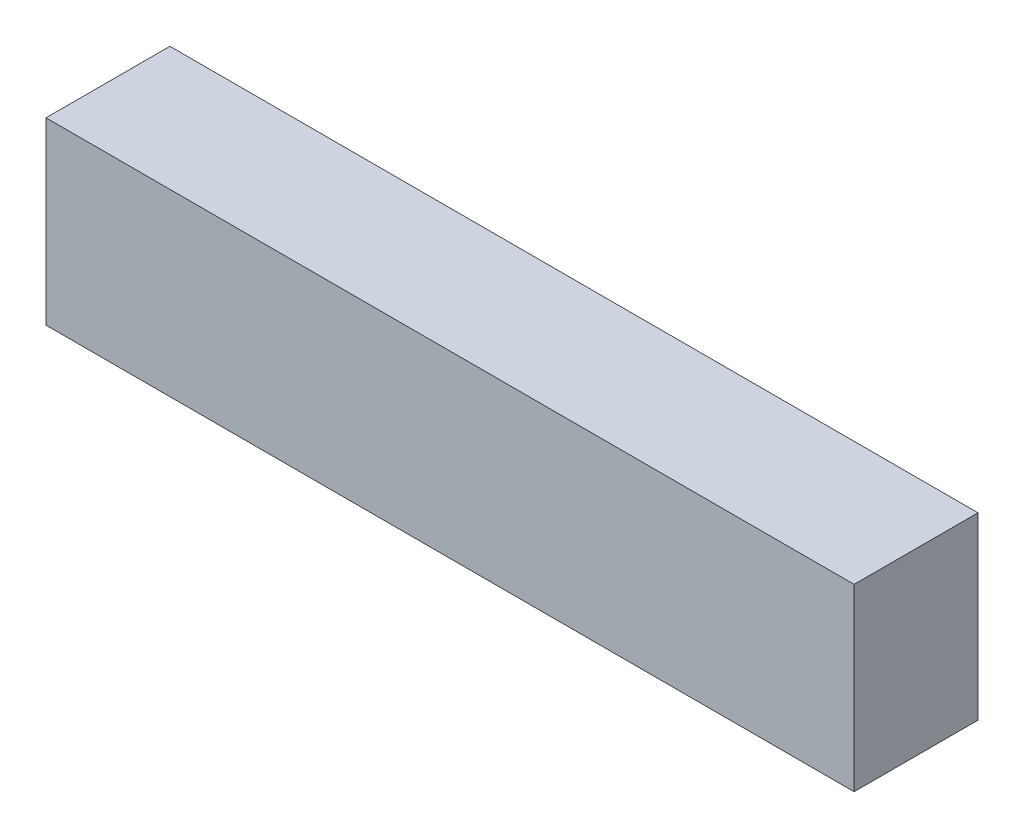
SolidWorks part; units mm, degrees
ref_plane "Front Plane" through (0, 0, 0) normal (0, 0, 1) x (1, 0, 0)
ref_plane "Top Plane" through (0, 0, 0) normal (0, 1, 0) x (1, 0, 0)
ref_plane "Right Plane" through (0, 0, 0) normal (1, 0, 0) x (0, 0, -1)
sketch "Sketch1" plane through (0, 0, 0) normal (0, 0, 1) x (1, 0, 0)
  line L1 (0, 0) -> (57.15, 0)
  line L2 (0, 0) -> (0, 12.7)
  line L3 (0, 12.7) -> (57.15, 12.7)
  line L4 (57.15, 0) -> (57.15, 12.7)
  dimension "D1" = 12.7
  dimension "D2" = 57.15
extrude "Boss-Extrude1" add sketch "Sketch1" along normal blind 8.763
